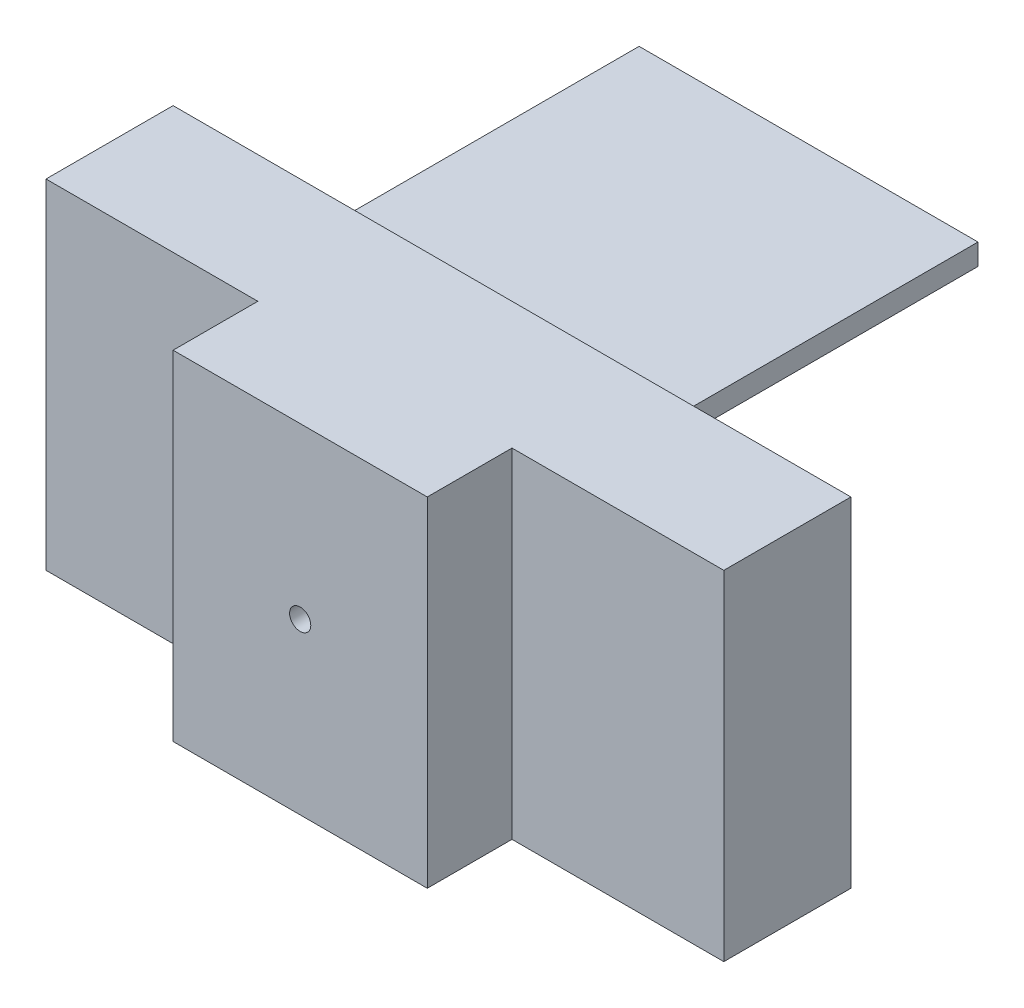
SolidWorks part; units mm, degrees
ref_plane "Plan de face" through (0, 0, 0) normal (0, 0, 1) x (1, 0, 0)
ref_plane "Plan de dessus" through (0, 0, 0) normal (0, 1, 0) x (1, 0, 0)
ref_plane "Plan de droite" through (0, 0, 0) normal (1, 0, 0) x (0, 0, -1)
sketch "Esquisse1" plane through (0, 0, 0) normal (0, 0, 1) x (1, 0, 0)
  line L1 (-80, 40) -> (80, 40)
  line L2 (-80, 40) -> (-80, -40)
  line L3 (-80, -40) -> (80, -40)
  line L4 (80, 40) -> (80, -40)
  line L5 (-80, 40) -> (80, -40) construction
  line L6 (-80, -40) -> (80, 40) construction
  point P0 (0, 0)
  dimension "D1" = 160
  dimension "D2" = 80
extrude "Boss.-Extru.1" add sketch "Esquisse1" along normal blind 50 contours L2 L1 L4 L3
sketch "Esquisse3" plane through (0, 0, 50) normal (0, 0, 1) x (1, 0, 0)
  line L0 (-80, -40) -> (80, -40) construction
  line L1 (-80, 40) -> (-30, 40)
  line L2 (-80, 40) -> (-80, -40)
  line L3 (-80, -40) -> (-30, -40)
  line L4 (-30, 40) -> (-30, -40)
  line L6 (80, 40) -> (30, 40)
  line L7 (80, 40) -> (80, -40)
  line L8 (80, -40) -> (30, -40)
  line L9 (30, 40) -> (30, -40)
  dimension "D1" = 50
  dimension "D2" = 50
extrude "Enlèv. mat.-Extru.5" cut sketch "Esquisse3" against normal blind 20 contours L9 M12 M10 M11 | L2 L1 L4 L3
sketch "Esquisse5" plane through (0, 0, 50) normal (0, 0, 1) x (1, 0, 0)
  line L0 (2.488, -0.2441) -> (2.488, 0.2426)
  line L1 (2.5, 0) -> (2.488, 0)
  line L3 (0.2327, 2.4891) -> (-0.2566, 2.4868)
  line L4 (-0.0119, 2.488) -> (-0.0119, 2.5)
  circle A0 centre (0, 0) radius 2.5
  point P9 (2.488, -0.2441)
  point P10 (2.488, 0.2426)
  dimension "D1" = 5
  dimension "D2" = 0.012
  dimension "D5" = 0.012
extrude "Enlèv. mat.-Extru.7" cut sketch "Esquisse5" against normal blind 22
sketch "Esquisse8" plane through (0, 0, 0) normal (0, 0, -1) x (-1, 0, 0)
  line L0 (80, 40) -> (80, -40) construction
  line L1 (-40, 32.1184) -> (40, 32.1184)
  line L2 (-40, 32.1184) -> (-40, 22.1184)
  line L3 (-40, 22.1184) -> (40, 22.1184)
  line L4 (40, 32.1184) -> (40, 22.1184)
  dimension "D1" = 80
  dimension "D2" = 10
  dimension "D3" = 40
extrude "Enlèv. mat.-Extru.8" cut sketch "Esquisse8" against normal blind 5 contours L2 L1 L4 L3
sketch "Esquisse9" plane through (0, 0, 0) normal (0, 0, -1) x (-1, 0, 0)
  line L1 (-40, 32.1184) -> (40, 32.1184)
  line L2 (-40, 32.1184) -> (-40, 37.1184)
  line L3 (-40, 37.1184) -> (40, 37.1184)
  line L4 (40, 32.1184) -> (40, 37.1184)
  dimension "D1" = 5
extrude "Boss.-Extru.5" add sketch "Esquisse9" along normal blind 70 contours L2 L1 L4 L3
